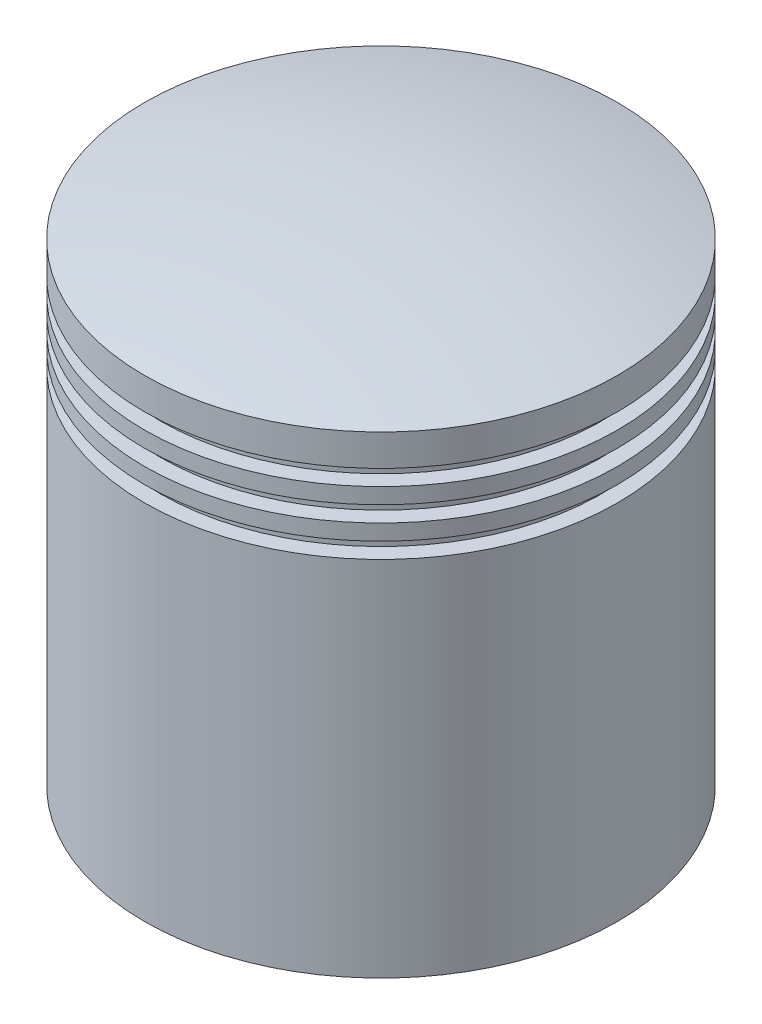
SolidWorks part; units mm, degrees
ref_plane "Front Plane" through (0, 0, 0) normal (0, 0, 1) x (1, 0, 0)
ref_plane "Top Plane" through (0, 0, 0) normal (0, 1, 0) x (1, 0, 0)
ref_plane "Right Plane" through (0, 0, 0) normal (1, 0, 0) x (0, 0, -1)
sketch "Sketch1" plane through (0, 0, 0) normal (0, 0, 1) x (1, 0, 0)
  line L0 (0, 160) -> (0, 0) construction
  line L1 (60, 135) -> (60, 65)
  line L2 (65, 0) -> (75, 0)
  line L3 (75, 115) -> (75, 0)
  line L12 (75, 115) -> (70, 115)
  line L13 (70, 115) -> (70, 120)
  line L14 (70, 120) -> (75, 120)
  line L15 (75, 120) -> (75, 125)
  line L16 (75, 125) -> (70, 125)
  line L17 (70, 125) -> (70, 130)
  line L18 (70, 130) -> (75, 130)
  line L19 (75, 130) -> (75, 135)
  line L20 (75, 135) -> (70, 135)
  line L21 (70, 135) -> (70, 140)
  line L22 (70, 140) -> (75, 140)
  line L23 (75, 140) -> (75, 150)
  line L24 (60, 135) -> (0, 135)
  line L25 (0, 135) -> (0, 160)
  line L27 (60, 65) -> (65, 65)
  line L30 (65, 65) -> (65, 0)
  arc A0 (75, 150) -> (0, 160) centre (0, -126.25) ccw
  dimension "D4" = 160
  dimension "D1" = 120
  dimension "D2" = 150
  dimension "D3" = 140
  dimension "D5" = 5
  dimension "D6" = 5
  dimension "D7" = 115
  dimension "D8" = 135
  dimension "D9" = 65
  dimension "D10" = 130
  dimension "D11" = 150
revolve "Revolve1" add sketch "Sketch1" angle 360 about L0
